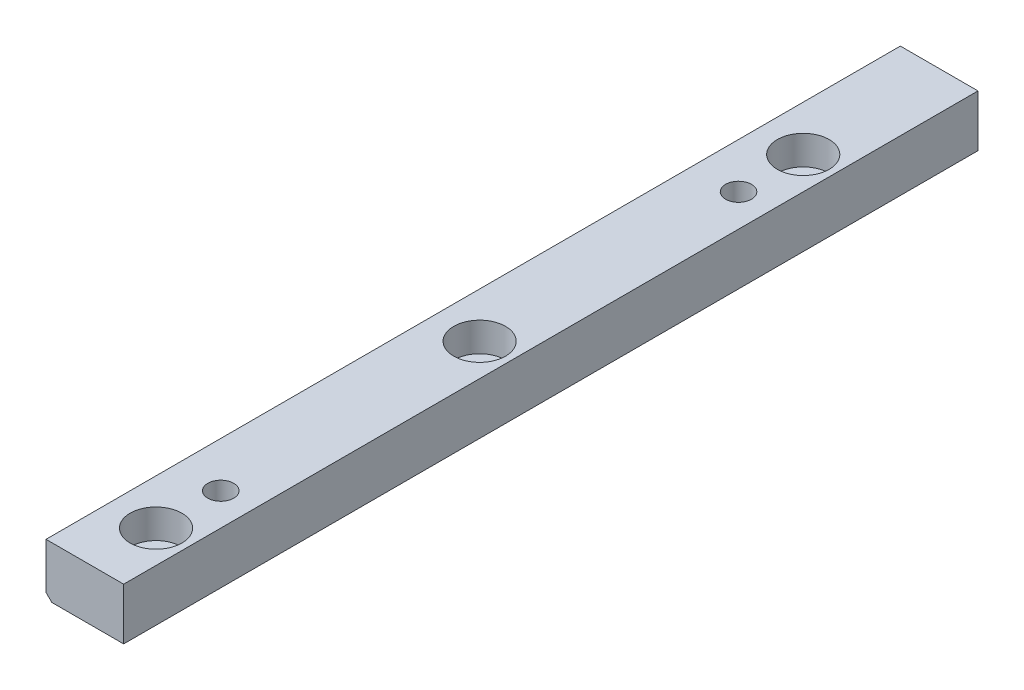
SolidWorks part; units mm, degrees
ref_plane "前视基准面" through (0, 0, 0) normal (0, 0, 1) x (1, 0, 0)
ref_plane "上视基准面" through (0, 0, 0) normal (0, 1, 0) x (1, 0, 0)
ref_plane "右视基准面" through (0, 0, 0) normal (1, 0, 0) x (0, 0, -1)
sketch "草图1" plane through (0, 0, 0) normal (0, 0, 1) x (1, 0, 0)
  line L0 (0, 0.9) -> (0, 8)
  line L1 (12, 0) -> (12, 8)
  line L2 (0.9, 0) -> (12, 0)
  line L3 (0, 8) -> (12, 8)
  line L4 (0, 0.9) -> (0.9, 0)
extrude "凸台-拉伸1" add sketch "草图1" along normal blind 132
sketch "草图2" plane through (0, 8, 0) normal (0, 1, 0) x (1, 0, 0)
  circle A0 centre (7, -22) radius 2.25
  circle A1 centre (7, -72) radius 2.25
  circle A2 centre (7, -122) radius 2.25
  circle A3 centre (7, -32) radius 2
  circle A4 centre (7, -112) radius 2
extrude "切除-拉伸1" cut sketch "草图2" against normal blind 132
sketch "草图3" plane through (0, 8, 0) normal (0, 1, 0) x (1, 0, 0)
  circle A0 centre (7, -22) radius 4
  circle A1 centre (7, -72) radius 4
  circle A2 centre (7, -122) radius 4
extrude "切除-拉伸2" cut sketch "草图3" against normal blind 4.5
